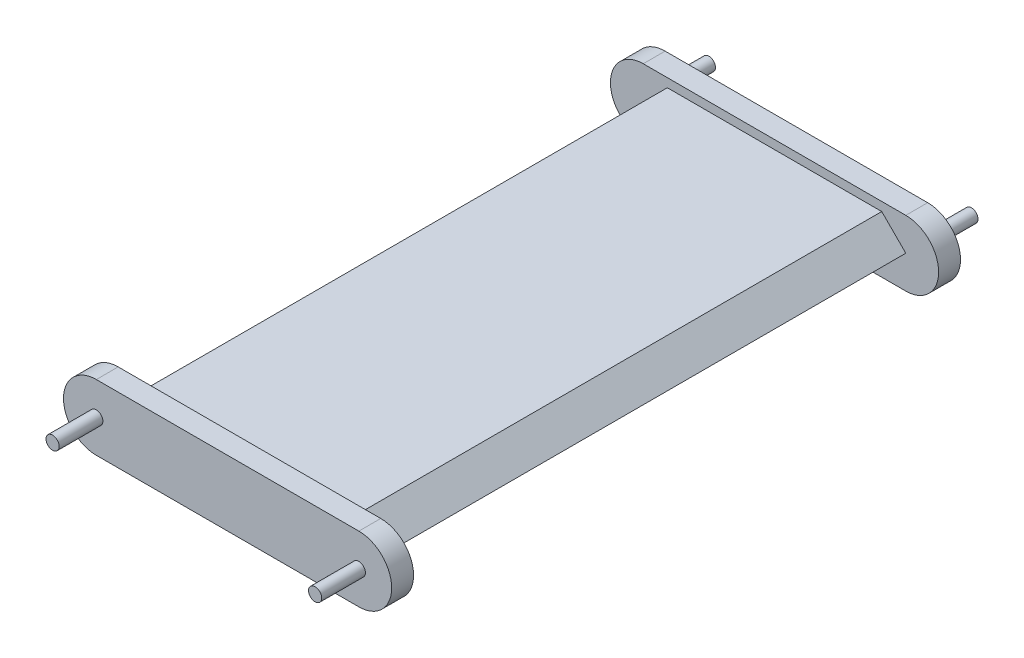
SolidWorks part; units mm, degrees
ref_plane "Plane1" through (0, 0, 0) normal (0, 0, 1) x (1, 0, 0)
ref_plane "Plane2" through (0, 0, 0) normal (0, 1, 0) x (1, 0, 0)
ref_plane "Plane3" through (0, 0, 0) normal (1, 0, 0) x (0, 0, -1)
sketch "Sketch1" plane through (0, 0, 0) normal (0, 0, 1) x (1, 0, 0)
  line L1 (-76.2, 19.05) -> (76.2, 19.05)
  line L3 (-76.2, -19.05) -> (76.2, -19.05)
  arc A0 (76.2, 19.05) -> (76.2, -19.05) centre (76.2, 0) cw
  arc A1 (-76.2, -19.05) -> (-76.2, 19.05) centre (-76.2, 0) cw
  point P6 (0, -19.05)
  dimension "D1" = 152.4
  dimension "D2" = 19.05
extrude "Base-Extrude" add sketch "Sketch1" along normal blind 12.7
sketch "Sketch2" plane through (0, 0, 12.7) normal (0, 0, 1) x (1, 0, 0)
  circle A0 centre (76.2, 0) radius 3.81
  circle A1 centre (-76.2, 0) radius 3.81
  dimension "D1" = 7.62
extrude "Boss-Extrude1" add sketch "Sketch2" along normal blind 25.4
sketch "Sketch4" plane through (0, 0, 0) normal (0, 0, -1) x (-1, 0, 0)
  line L0 (-76.2, 19.05) -> (76.2, 19.05) construction
  line L1 (76.2, -13.97) -> (-76.2, -13.97)
  line L2 (76.2, -13.97) -> (76.2, 13.97)
  line L3 (76.2, 13.97) -> (-76.2, 13.97)
  line L4 (-76.2, -13.97) -> (-76.2, 13.97)
  line L5 (76.2, -19.05) -> (-76.2, -19.05) construction
  dimension "D3" = 5.08
  dimension "D4" = 5.08
extrude "Boss-Extrude2" add sketch "Sketch4" along normal blind 304.8
sketch "Sketch6" plane through (4.8861, -2.859, -304.8) normal (0, 0, -1) x (-1, 0, 0)
  line L1 (-71.3139, 21.909) -> (81.0861, 21.909)
  line L3 (-71.3139, -16.191) -> (81.0861, -16.191)
  arc A0 (81.0861, 21.909) -> (81.0861, -16.191) centre (81.0861, 2.859) cw
  arc A1 (-71.3139, -16.191) -> (-71.3139, 21.909) centre (-71.3139, 2.859) cw
  arc A2 (81.0861, -16.191) -> (81.0861, 21.909) centre (81.0861, 2.859) ccw construction
  point P6 (4.8861, -16.191)
  dimension "D1" = 152.4
  dimension "D2" = 19.05
extrude "Boss-Extrude3" add sketch "Sketch6" along normal blind 12.7
sketch "Sketch7" plane through (67.1637, -3.0467, -317.5) normal (0, 0, -1) x (-1, 0, 0)
  circle A0 centre (143.3637, 3.0467) radius 3.81
  circle A1 centre (-9.0363, 3.0467) radius 3.81
  circle A2 centre (143.3637, 3.0467) radius 3.81 construction
  circle A3 centre (-9.0363, 3.0467) radius 3.81 construction
  dimension "D1" = 7.62
extrude "Boss-Extrude4" add sketch "Sketch7" along normal blind 25.4
chamfer "Chamfer2" distance 13.97 angle 45 8 edges at (-76.2, 0, 0) (-76.2, -13.97, -152.4) (-76.2, 13.97, -152.4) (76.2, 0, 0) (76.2, 13.97, -152.4) (76.2, -13.97, -152.4) (-76.2, 0, -304.8) (76.2, 0, -304.8)
sketch "Sketch8" plane through (0, 0, -317.5) normal (0, 0, -1) x (-1, 0, 0)
  circle A0 centre (76.2, 0) radius 3.81 construction
  circle A1 centre (-76.2, 0) radius 3.81 construction
  point P0 (-76.2, 0)
  point P1 (76.2, 0)
sketch "Sketch9" plane through (0, 0, 12.7) normal (0, 0, 1) x (1, 0, 0)
  circle A0 centre (76.2, 0) radius 3.81 construction
  circle A1 centre (-76.2, 0) radius 3.81 construction
  point P0 (-76.2, 0)
  point P1 (76.2, 0)
